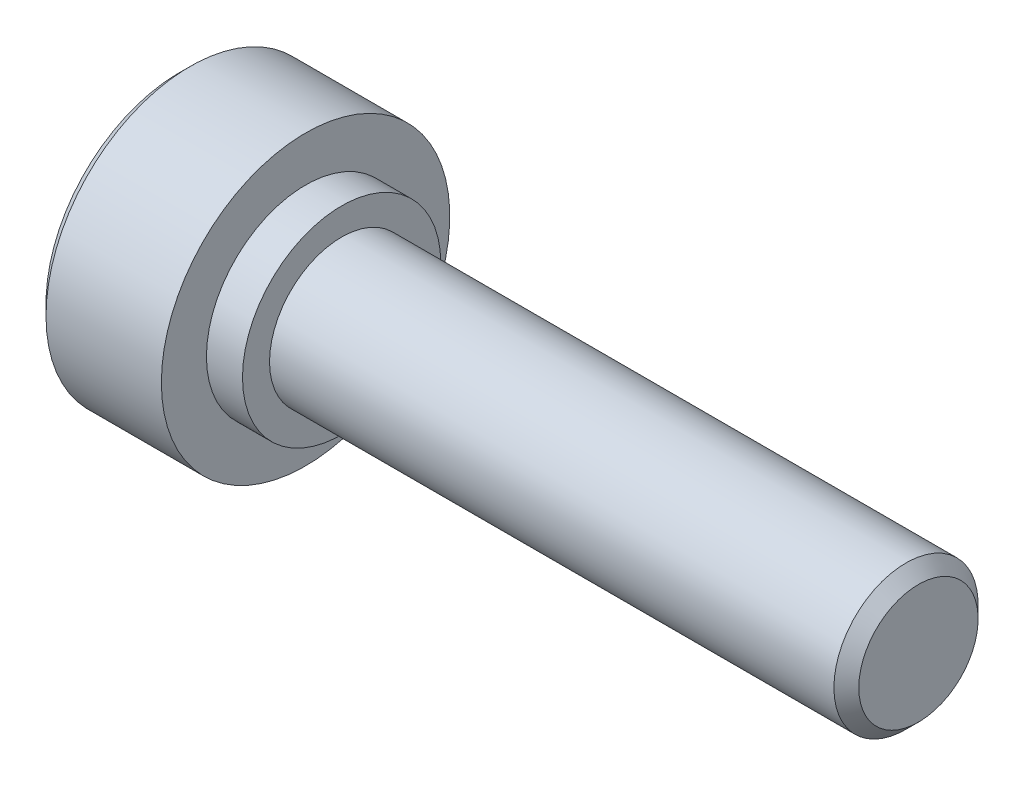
SolidWorks part; units mm, degrees
ref_plane "Plane1" through (0, 0, 0) normal (0, 0, 1) x (1, 0, 0)
ref_plane "Plane2" through (0, 0, 0) normal (0, 1, 0) x (1, 0, 0)
ref_plane "Plane3" through (0, 0, 0) normal (1, 0, 0) x (0, 0, -1)
sketch "BodySke" plane through (0, 0, 0) normal (0, 0, 1) x (1, 0, 0)
  line L0 (0, 0) -> (0, 8)
  line L2 (0, 8) -> (7, 8)
  line L3 (7, 8) -> (7, 5.5)
  line L6 (7, 5.5) -> (9, 5.5)
  line L7 (9, 5.5) -> (9, 4)
  line L10 (9, 4) -> (40.3095, 4)
  line L11 (40.3095, 4) -> (41, 3.3095)
  line L12 (41, 3.3095) -> (41, 0)
  line L13 (41, 0) -> (0, 0)
  line L14 (-6.35, 0) -> (107.95, 0) construction
  line L21 (9, 7.0856) -> (9, -8.764) construction
  dimension "D1" = 8
  dimension "Head_dia" = 16
  dimension "D2" = 0.6905
  dimension "Head_ht" = 7
  dimension "D3" = 5.5
  dimension "Thread_ch_ang" = 45
  dimension "Thread_length" = 32
  dimension "Length" = 2
revolve "BaseBody" add sketch "BodySke" angle 360 about L14
chamfer "Chamfer1" distance 0.6 1 edges at (0, 0, 8)
sketch "Sketch2" plane through (0, 0, 0) normal (0, 0, 1) x (1, 0, 0)
  line L0 (0, 3) -> (4.2, 3)
  line L1 (4.2, 3) -> (5.9321, 0)
  line L3 (5.9321, 0) -> (0, 0)
  line L4 (0, 0) -> (0, 3)
  line L5 (0, -3) -> (4.2, -3) construction
  line L6 (0, 0) -> (47.625, 0) construction
  dimension "D2" = 60
  dimension "PreBroach_depth" = 4.2
  dimension "PreBroach_dia" = 6
revolve "PreBroach" cut sketch "Sketch2" angle 360 about L6
sketch "Sketch3" plane through (0, 0, 0) normal (-1, 0, 0) x (0, 0, 1)
  line L0 (-3, -1.7321) -> (-3, 1.7321)
  line L1 (-3, 1.7321) -> (0, 3.4641)
  line L2 (0, 3.4641) -> (3, 1.7321)
  line L3 (3, 1.7321) -> (3, -1.7321)
  line L4 (3, -1.7321) -> (0, -3.4641)
  line L5 (0, -3.4641) -> (-3, -1.7321)
  dimension "D1" = 3
  dimension "Hex_size" = 6
  dimension "D2" = 3
  dimension "D3" = 120
  dimension "D4" = 6
extrude "Hex" cut sketch "Sketch3" against normal blind 4.2
